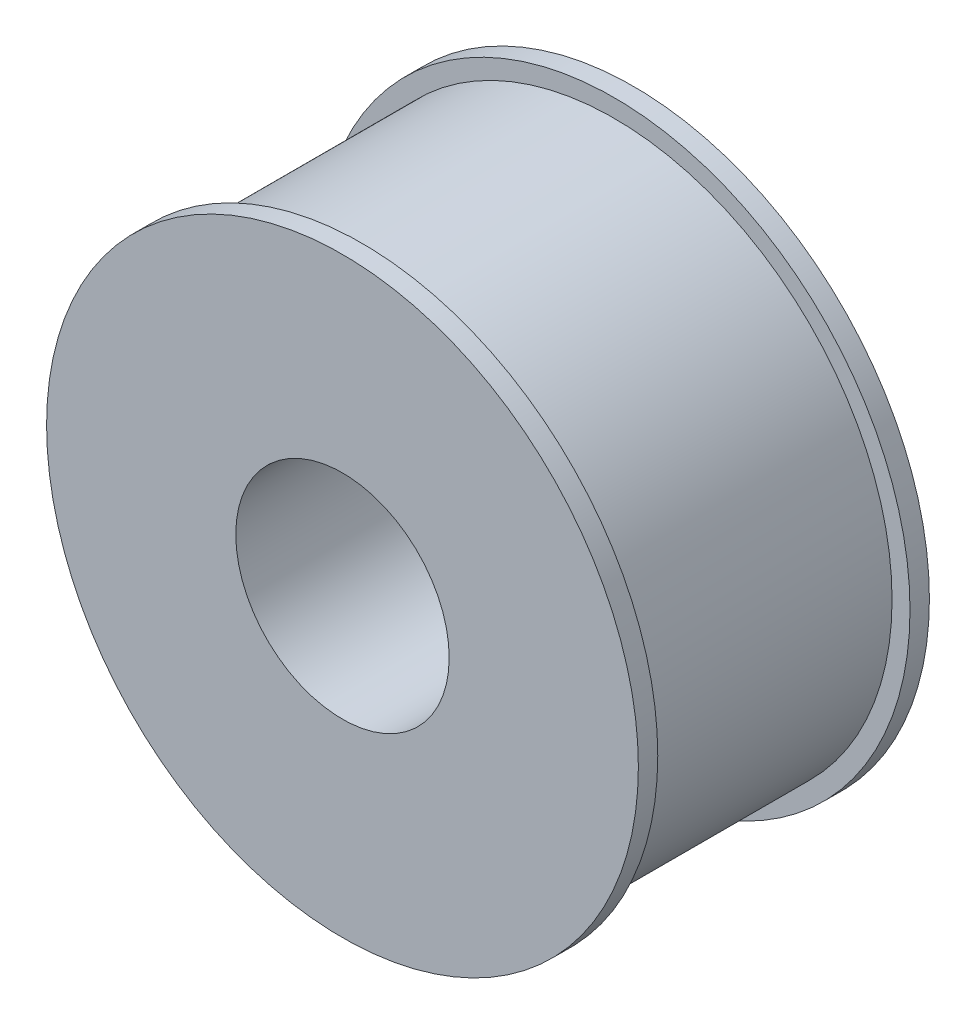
SolidWorks part; units mm, degrees
other "Markup1"
sketch "Sketch2" plane through (30.5, -30.5, 0) normal (0.9536, -0.2879, 0.0877) x (-0.1432, -0.6904, -0.7092)
ref_plane "Front Plane" through (0, 0, 0) normal (0, 0, 1) x (1, 0, 0)
ref_plane "Top Plane" through (0, 0, 0) normal (0, 1, 0) x (1, 0, 0)
ref_plane "Right Plane" through (0, 0, 0) normal (1, 0, 0) x (0, 0, -1)
sketch "Sketch1" plane through (0, 0, 0) normal (1, 0, 0) x (0, 0, -1)
  line L0 (0, 0) -> (0, 30.5)
  line L1 (0, 30.5) -> (2, 30.5)
  line L2 (2, 30.5) -> (2, 28.65)
  line L3 (2, 28.65) -> (28, 28.65)
  line L4 (28, 28.65) -> (28, 30.5)
  line L5 (28, 30.5) -> (30, 30.5)
  line L6 (30, 30.5) -> (30, 19)
  line L7 (30, 19) -> (36, 19)
  line L8 (36, 19) -> (36, 0)
  line L9 (-18.1622, 0) -> (60.1622, 0) construction
  line L10 (0, 0) -> (36, 0)
  dimension "D1" = 57.3
  dimension "D2" = 36
  dimension "D3" = 30
  dimension "D4" = 2
  dimension "D5" = 2
  dimension "D6" = 61
  dimension "D7" = 61
  dimension "D8" = 38
revolve "Revolve1" add sketch "Sketch1" angle 360 about L9
sketch "Sketch3" plane through (0, 0, -36) normal (0, 0, -1) x (-1, 0, 0)
  circle A0 centre (0, 0) radius 11
  dimension "D1" = 22
extrude "Cut-Extrude1" cut sketch "Sketch3" against normal through all
sketch "Sketch4" plane through (0, 0, 0) normal (0, 1, 0) x (1, 0, 0)
  point P0 (0, 33)
  dimension "D1" = 3
sketch "Sketch8" plane through (0, 0, 0) normal (1, 0, 0) x (0, 0, -1)
  circle A0 centre (33, 0) radius 2.1
  dimension "D1" = 4.2
extrude "Cut-Extrude2" cut sketch "Sketch8" against normal through all
